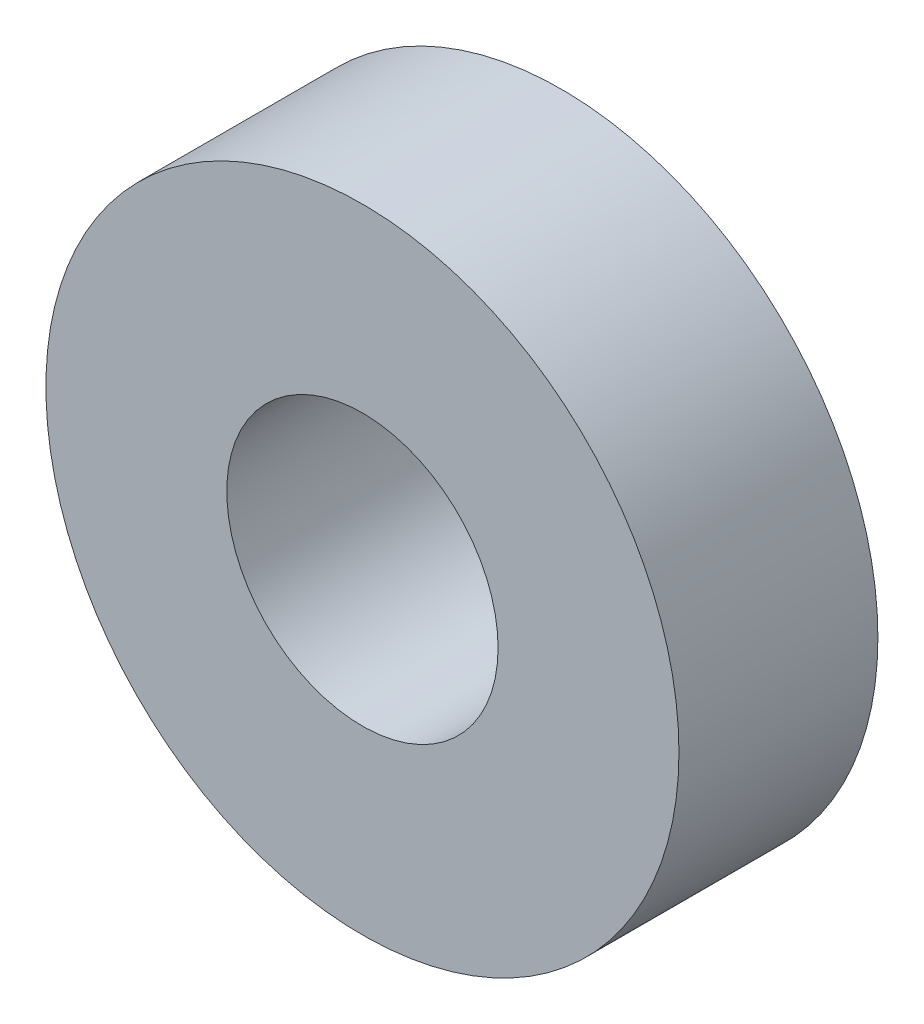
SolidWorks part; units mm, degrees
ref_plane "Front Plane" through (0, 0, 0) normal (0, 0, 1) x (1, 0, 0)
ref_plane "Top Plane" through (0, 0, 0) normal (0, 1, 0) x (1, 0, 0)
ref_plane "Right Plane" through (0, 0, 0) normal (1, 0, 0) x (0, 0, -1)
sketch "Sketch1" plane through (0, 0, 0) normal (0, 0, 1) x (1, 0, 0)
  circle A0 centre (0, 0) radius 17.5
  dimension "D1" = 35
extrude "Boss-Extrude1" add sketch "Sketch1" along normal blind 11 contours A0
sketch "Sketch2" plane through (0, 0, 11) normal (0, 0, 1) x (1, 0, 0)
  circle A1 centre (0, 0) radius 7.5
  dimension "D1" = 15
extrude "Cut-Extrude1" cut sketch "Sketch2" against normal through all
